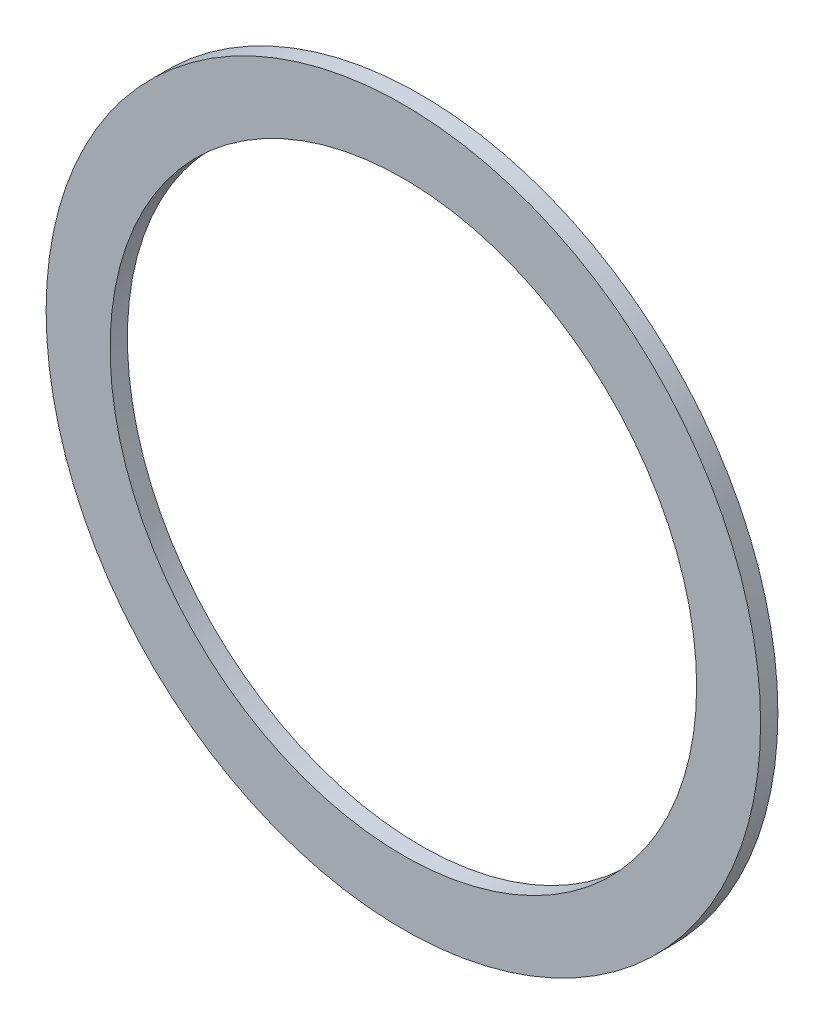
SolidWorks part; units mm, degrees
ref_plane "Front" through (0, 0, 0) normal (0, 0, 1) x (1, 0, 0)
ref_plane "Top" through (0, 0, 0) normal (0, 1, 0) x (1, 0, 0)
ref_plane "Right" through (0, 0, 0) normal (1, 0, 0) x (0, 0, -1)
sketch "Sketch1" plane through (0, 0, 0) normal (0, 0, 1) x (1, 0, 0)
  circle A0 centre (0, 0) radius 7.874
  circle A1 centre (0, 0) radius 6.4643
  dimension "D1" = 15.748
  dimension "D2" = 12.9286
extrude "Base-Extrude" add sketch "Sketch1" against normal blind 0.381
